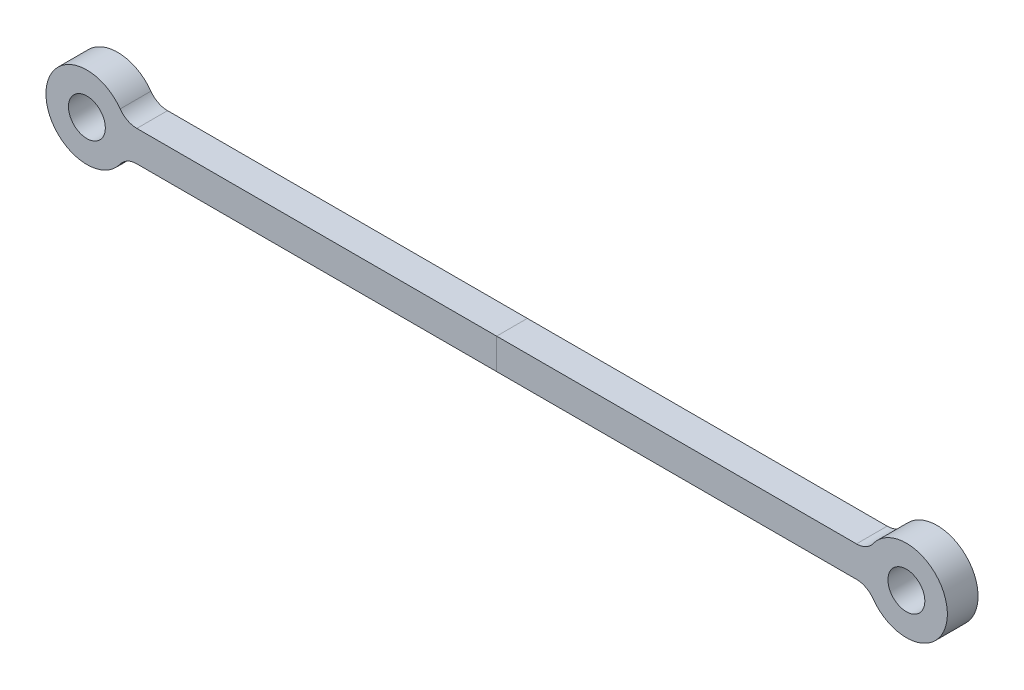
SolidWorks part; units mm, degrees
ref_plane "Front" through (0, 0, 0) normal (0, 0, 1) x (1, 0, 0)
ref_plane "Top" through (0, 0, 0) normal (0, 1, 0) x (1, 0, 0)
ref_plane "Right" through (0, 0, 0) normal (1, 0, 0) x (0, 0, -1)
sketch "Sketch1" plane through (0, 0, 0) normal (0, 0, 1) x (1, 0, 0)
  line L0 (0, 0) -> (325.6723, 0) construction
  line L1 (0, 0) -> (0, 87.9437) construction
  line L2 (-400, 15) -> (400, 15)
  line L3 (-400, -15) -> (400, -15)
  arc A0 (-400, 15) -> (-400, -15) centre (-400, 0) ccw
  arc A1 (400, -15) -> (400, 15) centre (400, 0) ccw
  dimension "D1" = 800
  dimension "D2" = 15
  dimension "D3" = 30
  dimension "D4" = 400
extrude "Extrude1" add sketch "Sketch1" along normal blind 30
sketch "Sketch2" plane through (0, 0, 30) normal (0, 0, 1) x (1, 0, 0)
  circle A0 centre (-400, 0) radius 40
  arc A1 (-400, 15) -> (-400, -15) centre (-400, 0) ccw construction
  dimension "D1" = 80
extrude "Extrude2" add sketch "Sketch2" against normal up to surface (30 mm away)
sketch "Sketch3" plane through (0, 0, 30) normal (0, 0, 1) x (1, 0, 0)
  circle A0 centre (-400, 0) radius 18
  dimension "D1" = 36
extrude "Cut-Extrude1" cut sketch "Sketch3" against normal through all
fillet "Fillet1" radius 20 2 edges at (-362.919, -15, 15) (-362.919, 15, 15)
mirror "Mirror1" about plane through (0, 0, 0) normal (1, 0, 0) of "Fillet1", "Extrude2", "Cut-Extrude1"
sketch "Sketch4" plane through (0, 0, 0) normal (0, 0, 1) x (1, 0, 0)
  line L0 (0, 15) -> (0, -15)
  line L1 (351.266, 15) -> (-351.266, 15) construction
  line L2 (-351.266, -15) -> (351.266, -15) construction
